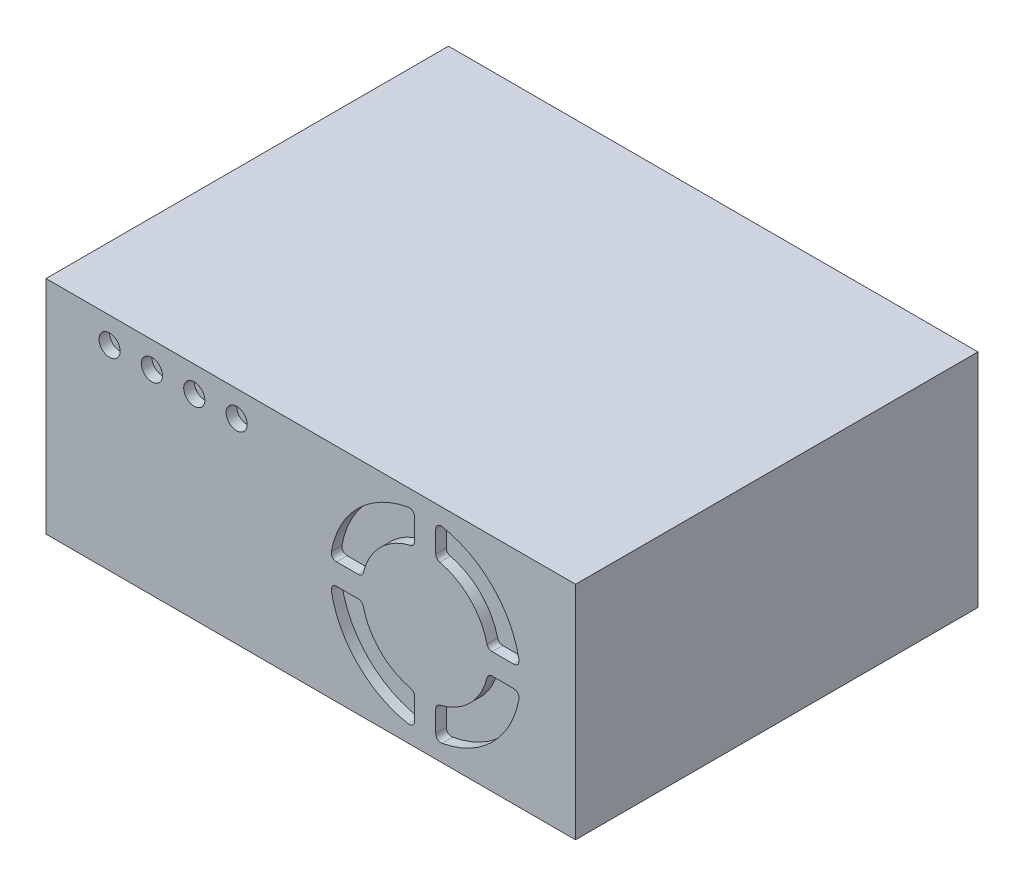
SolidWorks part; units mm, degrees
ref_plane "Front Plane" through (0, 0, 0) normal (0, 0, 1) x (1, 0, 0)
ref_plane "Top Plane" through (0, 0, 0) normal (0, 1, 0) x (1, 0, 0)
ref_plane "Right Plane" through (0, 0, 0) normal (1, 0, 0) x (0, 0, -1)
sketch "Sketch1" plane through (0, 0, 0) normal (0, 1, 0) x (1, 0, 0)
  line L1 (0, 0) -> (50, 0)
  line L2 (0, 0) -> (0, 38)
  line L3 (0, 38) -> (50, 38)
  line L4 (50, 0) -> (50, 38)
  dimension "D1" = 50
  dimension "D2" = 38
extrude "Boss-Extrude1" add sketch "Sketch1" along normal blind 20.9
sketch "Sketch2" plane through (0, 0, 0) normal (0, 0, 1) x (1, 0, 0)
  line L0 (50, 20.9) -> (50, 0) construction
  line L1 (0, 20.9) -> (0, 0) construction
  line L2 (42.1246, 11.45) -> (44.1666, 11.45)
  line L4 (34.8, 18.8166) -> (34.8, 16.7746)
  line L6 (36.8, 18.8166) -> (36.8, 16.7746)
  line L7 (27.4334, 11.45) -> (29.4754, 11.45)
  line L9 (27.4334, 9.45) -> (29.4754, 9.45)
  line L11 (42.1246, 9.45) -> (44.1666, 9.45)
  line L12 (36.8, 4.1254) -> (36.8, 2.0834)
  line L13 (34.8, 4.1254) -> (34.8, 2.0834)
  arc A0 (26.9412, 8.8618) -> (34.2118, 1.5912) centre (35.8, 10.45) ccw
  arc A1 (29.9619, 9.0654) -> (34.4154, 4.6119) centre (35.8, 10.45) ccw
  arc A2 (37.1846, 4.6119) -> (41.6381, 9.0654) centre (35.8, 10.45) ccw
  arc A3 (37.3882, 1.5912) -> (44.6588, 8.8618) centre (35.8, 10.45) ccw
  arc A4 (34.4154, 16.2881) -> (29.9619, 11.8346) centre (35.8, 10.45) ccw
  arc A5 (34.2118, 19.3088) -> (26.9412, 12.0382) centre (35.8, 10.45) ccw
  arc A6 (41.6381, 11.8346) -> (37.1846, 16.2881) centre (35.8, 10.45) ccw
  arc A7 (44.6588, 12.0382) -> (37.3882, 19.3088) centre (35.8, 10.45) ccw
  arc A8 (37.3882, 19.3088) -> (36.8, 18.8166) centre (37.3, 18.8166) ccw
  arc A9 (36.8, 16.7746) -> (37.1846, 16.2881) centre (37.3, 16.7746) ccw
  arc A10 (42.1246, 11.45) -> (41.6381, 11.8346) centre (42.1246, 11.95) cw
  arc A11 (44.6588, 12.0382) -> (44.1666, 11.45) centre (44.1666, 11.95) cw
  arc A12 (44.6588, 8.8618) -> (44.1666, 9.45) centre (44.1666, 8.95) ccw
  arc A13 (42.1246, 9.45) -> (41.6381, 9.0654) centre (42.1246, 8.95) ccw
  arc A14 (37.1846, 4.6119) -> (36.8, 4.1254) centre (37.3, 4.1254) ccw
  arc A15 (37.3882, 1.5912) -> (36.8, 2.0834) centre (37.3, 2.0834) cw
  arc A16 (34.2118, 1.5912) -> (34.8, 2.0834) centre (34.3, 2.0834) ccw
  arc A17 (34.4154, 4.6119) -> (34.8, 4.1254) centre (34.3, 4.1254) cw
  arc A18 (29.9619, 9.0654) -> (29.4754, 9.45) centre (29.4754, 8.95) ccw
  arc A19 (27.4334, 9.45) -> (26.9412, 8.8618) centre (27.4334, 8.95) ccw
  arc A20 (29.9619, 11.8346) -> (29.4754, 11.45) centre (29.4754, 11.95) cw
  arc A21 (27.4334, 11.45) -> (26.9412, 12.0382) centre (27.4334, 11.95) cw
  arc A22 (34.8, 16.7746) -> (34.4154, 16.2881) centre (34.3, 16.7746) cw
  arc A23 (34.2118, 19.3088) -> (34.8, 18.8166) centre (34.3, 18.8166) cw
  point P6 (50, 10.45)
  point P28 (41.7161, 11.45)
  point P37 (36.8, 4.5339)
  point P44 (34.8, 4.5339)
  point P55 (34.8, 16.3661)
  dimension "D1" = 18
  dimension "D2" = 12
  dimension "D4" = 0.5
  dimension "D3" = 35.8
extrude "Fan holes" cut sketch "Sketch2" against normal blind 1
sketch "Sketch3" plane through (0, 0, -38) normal (0, 0, -1) x (-1, 0, 0)
  line L0 (-50, 20.9) -> (-50, 0) construction
  line L1 (-44.5, 12.9) -> (-27.5, 12.9)
  line L2 (-44.5, 12.9) -> (-44.5, 8)
  line L3 (-44.5, 8) -> (-27.5, 8)
  line L4 (-27.5, 12.9) -> (-27.5, 8)
  point P4 (-44.5, 10.45)
  point P7 (-50, 10.45)
  dimension "D1" = 17
  dimension "D2" = 4.9
  dimension "D3" = 5.5
extrude "Cable slot" cut sketch "Sketch3" against normal blind 2
sketch "Sketch4" plane through (0, 0, 0) normal (0, 0, 1) x (1, 0, 0)
  line L0 (0, 20.9) -> (50, 20.9) construction
  line L1 (0, 20.9) -> (0, 0) construction
  line L2 (6, 18.45) -> (10, 18.45) construction
  circle A0 centre (6, 18.45) radius 1
  circle A1 centre (10, 18.45) radius 1
  circle A2 centre (14, 18.45) radius 1
  circle A3 centre (18, 18.45) radius 1
  dimension "D1" = 2
  dimension "D2" = 2.45
  dimension "D3" = 6
  dimension "D5" = 4
  dimension "D4" = 4
extrude "Holes" cut sketch "Sketch4" against normal blind 1
